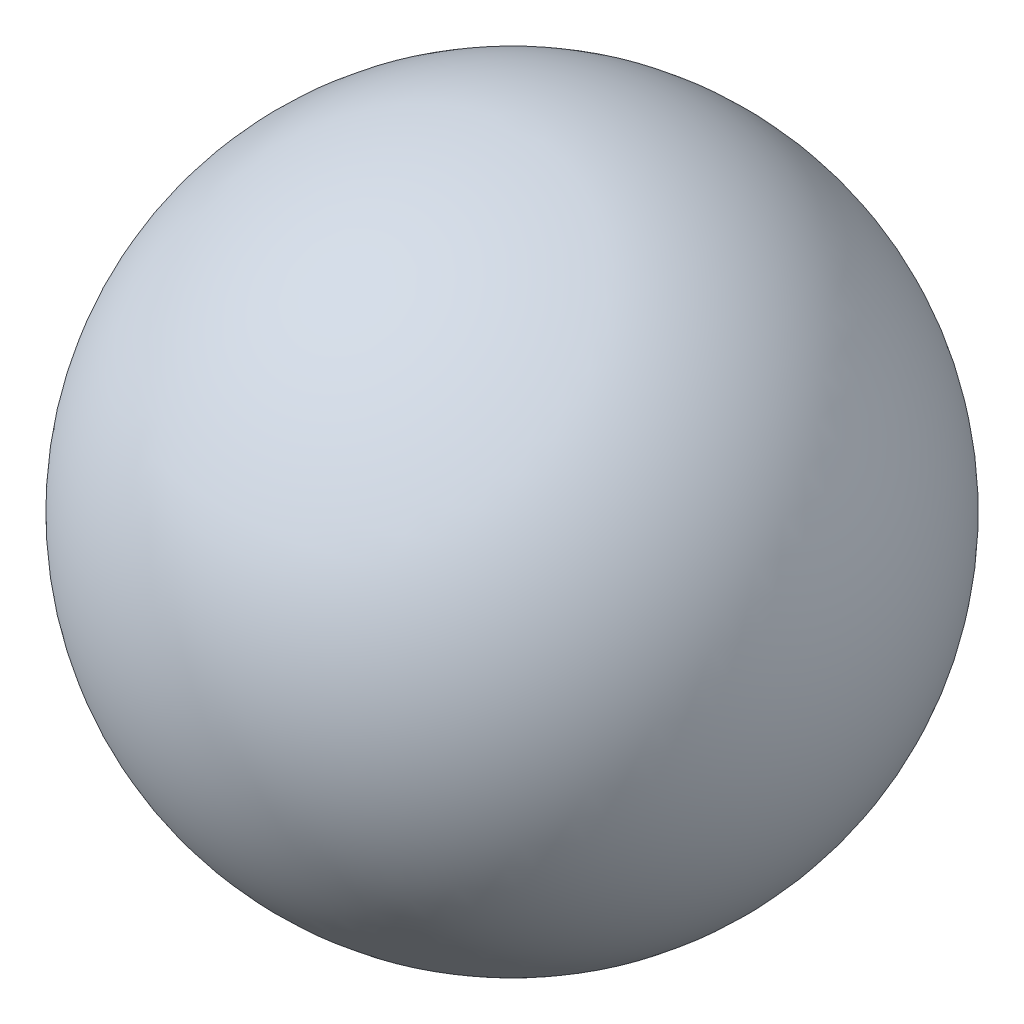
SolidWorks part; units mm, degrees
ref_plane "Front" through (0, 0, 0) normal (0, 0, 1) x (1, 0, 0)
ref_plane "Top" through (0, 0, 0) normal (0, 1, 0) x (1, 0, 0)
ref_plane "Right" through (0, 0, 0) normal (1, 0, 0) x (0, 0, -1)
sketch "Sketch1" plane through (0, 0, 0) normal (0, 0, 1) x (1, 0, 0)
  line L0 (0, 1.9844) -> (0, -1.9844)
  arc A0 (0, 1.9844) -> (0, -1.9844) centre (0, 0) ccw
  dimension "D1" = 3.9688
revolve "Revolve1" add sketch "Sketch1" angle 360 about L0
